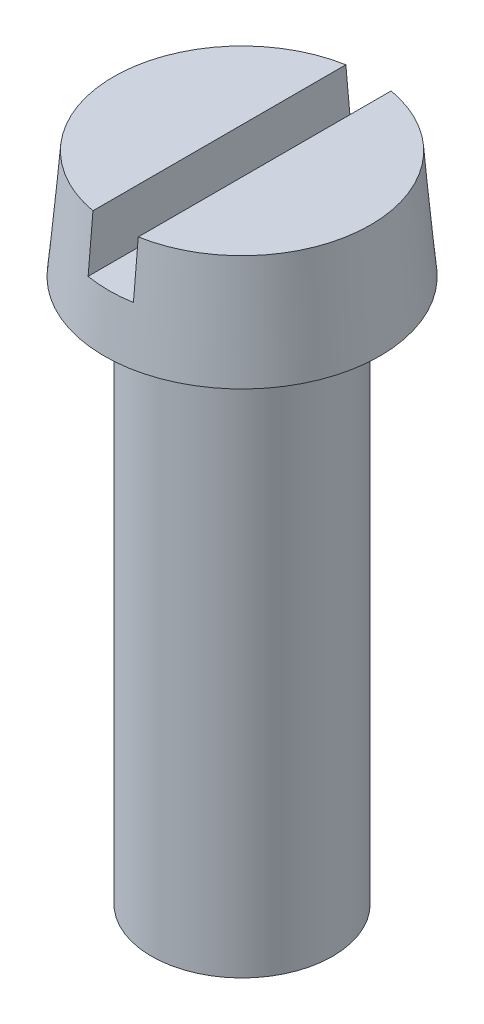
SolidWorks part; units mm, degrees
ref_plane "Front Plane" through (0, 0, 0) normal (0, 0, 1) x (1, 0, 0)
ref_plane "Top Plane" through (0, 0, 0) normal (0, 1, 0) x (1, 0, 0)
ref_plane "Right Plane" through (0, 0, 0) normal (1, 0, 0) x (0, 0, -1)
sketch "Sketch1" plane through (0, 0, 0) normal (0, 0, 1) x (1, 0, 0)
  line L0 (0, 108) -> (0, 0)
  line L1 (21.2695, 108) -> (22.8443, 90)
  line L2 (0, 108) -> (0, 135.1455) construction
  line L3 (22.8443, 90) -> (22.8443, 102.3081) construction
  line L7 (0, 0) -> (15, 0)
  line L8 (15, 0) -> (15, 90)
  line L9 (15, 90) -> (22.8443, 90)
  line L11 (0, 108) -> (21.2695, 108)
  line L12 (0, 0) -> (0, 108) construction
  dimension "D2" = 90
  dimension "D3" = 18
  dimension "D1" = 30
  dimension "D4" = 5
  dimension "D5" = 45.6887
revolve "Revolve1" add sketch "Sketch1" angle 360 about L12
ref_plane "Plane1" through (0, 120, 0) normal (0, 1, 0) x (-1, 0, 0)
sketch "Sketch3" plane through (0, 120, 0) normal (0, 1, 0) x (-1, 0, 0)
  line L0 (0, 25.8831) -> (0, -25.8831) construction
  line L1 (3.75, 25.8831) -> (-3.75, 25.8831)
  line L2 (3.75, 25.8831) -> (3.75, -25.8831)
  line L3 (3.75, -25.8831) -> (-3.75, -25.8831)
  line L4 (-3.75, 25.8831) -> (-3.75, -25.8831)
  point P6 (0, 0)
  dimension "D1" = 7.5
extrude "Extrude1" cut sketch "Sketch3" against normal offset from surface (21 mm away) 9
